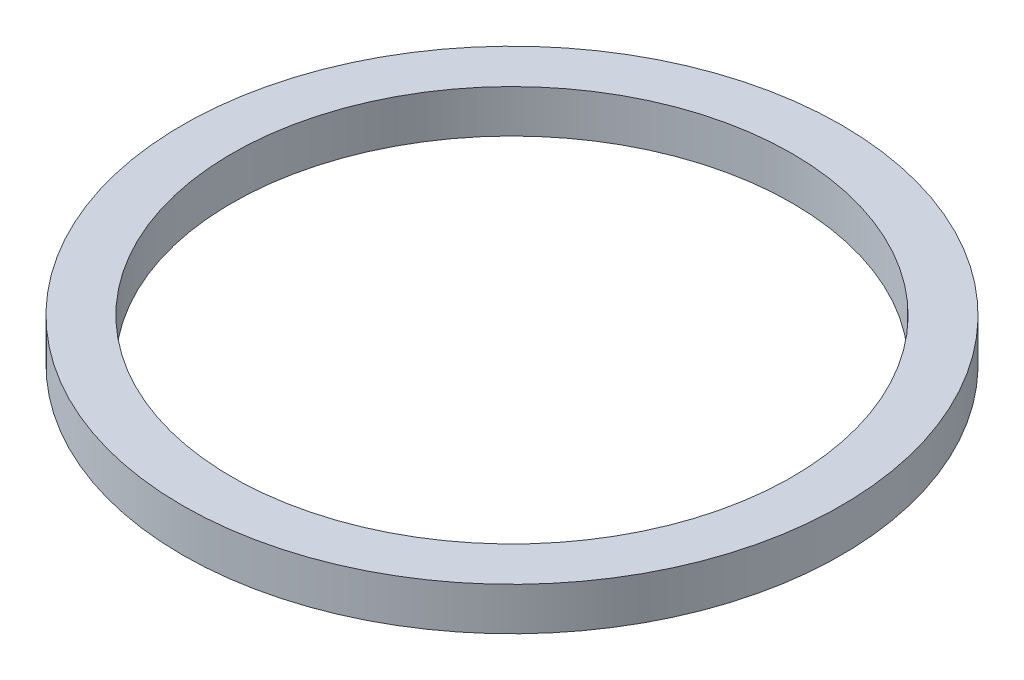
SolidWorks part; units mm, degrees
ref_plane "Front Plane" through (0, 0, 0) normal (0, 0, 1) x (1, 0, 0)
ref_plane "Top Plane" through (0, 0, 0) normal (0, 1, 0) x (1, 0, 0)
ref_plane "Right Plane" through (0, 0, 0) normal (1, 0, 0) x (0, 0, -1)
sketch "Sketch1" plane through (0, 0, 0) normal (0, 1, 0) x (1, 0, 0)
  circle A0 centre (0, 0) radius 8.5
  circle A1 centre (0, 0) radius 10
  dimension "D1" = 17
  dimension "D2" = 20
extrude "Extrude1" add sketch "Sketch1" along normal blind 1.3
